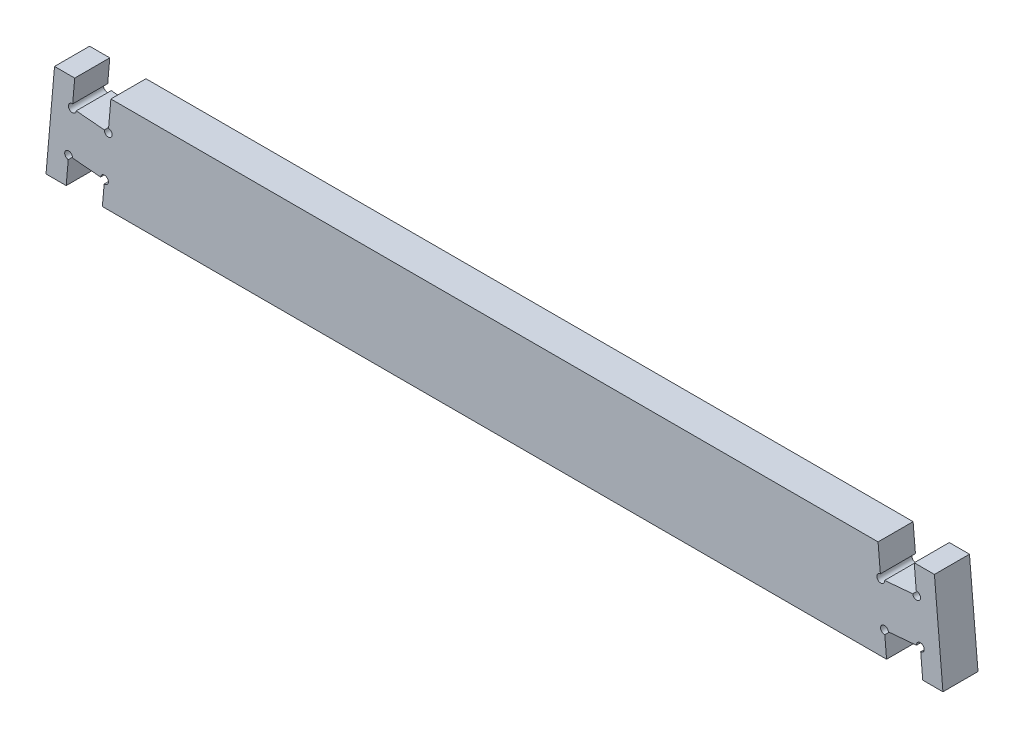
SolidWorks part; units mm, degrees
ref_plane "Front Plane" through (0, 0, 0) normal (0, 0, 1) x (1, 0, 0)
ref_plane "Top Plane" through (0, 0, 0) normal (0, 1, 0) x (1, 0, 0)
ref_plane "Right Plane" through (0, 0, 0) normal (1, 0, 0) x (0, 0, -1)
sketch "Sketch1" plane through (0, 0, 0) normal (0, 0, 1) x (1, 0, 0)
  line L0 (-234.4118, -301.4844) -> (196.0083, -301.4844) construction
  line L2 (199.4016, -312.4007) -> (180.972, -314.013)
  line L3 (-19.2018, -84.9863) -> (-19.2018, -445.1799) construction
  line L4 (-216.0921, -276.4844) -> (177.6886, -276.4844)
  line L5 (206.6191, -276.4844) -> (210.9936, -326.4844)
  line L6 (210.9936, -326.4844) -> (200.6337, -326.4844)
  line L7 (170.0468, 20.2577) -> (197.2113, -290.2344) construction
  line L8 (196.2593, -276.4844) -> (197.4841, -290.4844)
  line L9 (177.6886, -276.4844) -> (179.0545, -292.0968)
  line L10 (186.1647, -267.2348) -> (192.7249, -342.2184) construction
  line L11 (-235.8876, -290.4844) -> (-217.458, -292.0968)
  line L12 (180.972, -314.013) -> (182.0631, -326.4844)
  line L13 (199.4016, -312.4007) -> (200.6337, -326.4844)
  line L14 (196.2593, -276.4844) -> (206.6191, -276.4844)
  line L15 (182.0631, -326.4844) -> (-220.4666, -326.4844)
  line L16 (-234.6628, -276.4844) -> (-245.0227, -276.4844)
  line L17 (-237.8051, -312.4007) -> (-239.0372, -326.4844)
  line L18 (-219.3755, -314.013) -> (-220.4666, -326.4844)
  line L19 (-216.0921, -276.4844) -> (-217.458, -292.0968)
  line L20 (-234.6628, -276.4844) -> (-235.8876, -290.4844)
  line L21 (-249.3971, -326.4844) -> (-239.0372, -326.4844)
  line L22 (-245.0227, -276.4844) -> (-249.3971, -326.4844)
  line L23 (-237.8051, -312.4007) -> (-219.3755, -314.013)
  line L25 (197.4841, -290.4844) -> (179.0545, -292.0968)
  point P3 (-19.2018, -301.4844)
  point P4 (-227.5647, -301.4844)
  point P21 (189.1612, -301.4844)
  point P22 (-19.2018, -326.4844)
  point P25 (-19.2018, -326.4844)
  point P33 (-19.2018, -276.4844)
  point P34 (-19.2018, -326.4844)
  point P38 (-19.2018, -276.4844)
  dimension "D1" = 50
  dimension "D2" = 19.5704
  dimension "D3" = 208.3629
  dimension "D4" = 18.5
  dimension "D5" = 22
extrude "Boss-Extrude1" add sketch "Sketch1" along normal blind 18
sketch "Sketch2" plane through (0, 0, 18) normal (0, 0, 1) x (1, 0, 0)
  circle A0 centre (197.4841, -290.4844) radius 2
  circle A1 centre (179.0545, -292.0968) radius 2
  circle A2 centre (199.4016, -312.4007) radius 2
  circle A3 centre (180.972, -314.013) radius 2
  circle A4 centre (-217.458, -292.0968) radius 2
  circle A5 centre (-219.3755, -314.013) radius 2
  circle A6 centre (-235.8876, -290.4844) radius 2
  circle A7 centre (-237.8051, -312.4007) radius 2
  dimension "D1" = 4
extrude "Cut-Extrude1" cut sketch "Sketch2" against normal up to next
sketch "Sketch3" plane through (0, 0, 18) normal (0, 0, 1) x (1, 0, 0)
